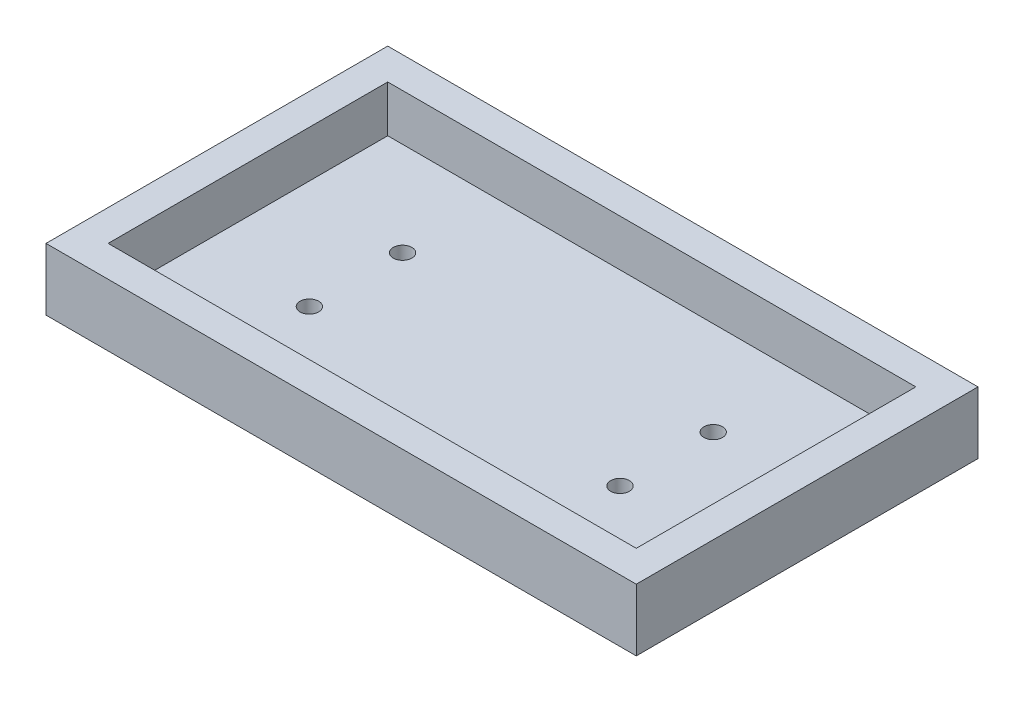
SolidWorks part; units mm, degrees
ref_plane "Front Plane" through (0, 0, 0) normal (0, 0, 1) x (1, 0, 0)
ref_plane "Top Plane" through (0, 0, 0) normal (0, 1, 0) x (1, 0, 0)
ref_plane "Right Plane" through (0, 0, 0) normal (1, 0, 0) x (0, 0, -1)
sketch "Sketch6" plane through (0, 0, 0) normal (0, 1, 0) x (1, 0, 0)
  line L1 (-14.5701, 5.0159) -> (155.4299, 5.0159)
  line L2 (-14.5701, 5.0159) -> (-14.5701, -84.9841)
  line L3 (-14.5701, -84.9841) -> (155.4299, -84.9841)
  line L4 (155.4299, 5.0159) -> (155.4299, -84.9841)
  line L9 (-24.5701, -94.9841) -> (165.4299, -94.9841)
  line L10 (-24.5701, -94.9841) -> (-24.5701, 15.0159)
  line L15 (-24.5701, 15.0159) -> (165.4299, 15.0159)
  line L16 (165.4299, -94.9841) -> (165.4299, 15.0159)
  line L17 (-24.5701, -94.9841) -> (165.4299, 15.0159) construction
  line L18 (-24.5701, 15.0159) -> (165.4299, -94.9841) construction
  point P4 (70.4299, -39.9841)
  point P12 (60.4299, -44.9841)
  point P13 (70.4299, -39.9841)
  dimension "D1" = 170
  dimension "D2" = 90
extrude "Boss-Extrude8" add sketch "Sketch6" along normal blind 15
ref_plane "Plane3" through (0, 0, 0) normal (0, -1, 0) x (-1, 0, 0)
sketch "Sketch9" plane through (0, 0, 0) normal (0, -1, 0) x (-1, 0, 0)
  line L1 (24.5701, -94.9841) -> (-165.4299, -94.9841)
  line L2 (24.5701, -94.9841) -> (24.5701, 15.0159)
  line L3 (24.5701, 15.0159) -> (-165.4299, 15.0159)
  line L4 (-165.4299, -94.9841) -> (-165.4299, 15.0159)
  line L5 (24.5701, -94.9841) -> (-165.4299, 15.0159) construction
  line L6 (24.5701, 15.0159) -> (-165.4299, -94.9841) construction
  line L15 (-20.4299, -25.2098) -> (-120.4299, -55.2098) construction
  line L16 (-20.4299, -55.2098) -> (-120.4299, -25.2098) construction
  circle A0 centre (-20.4299, -25.2098) radius 3
  circle A1 centre (-120.4299, -25.2098) radius 3
  circle A2 centre (-20.4299, -55.2098) radius 3
  circle A3 centre (-120.4299, -55.2098) radius 3
  point P4 (-70.4299, -39.9841)
extrude "Boss-Extrude9" add sketch "Sketch9" along normal blind 5
